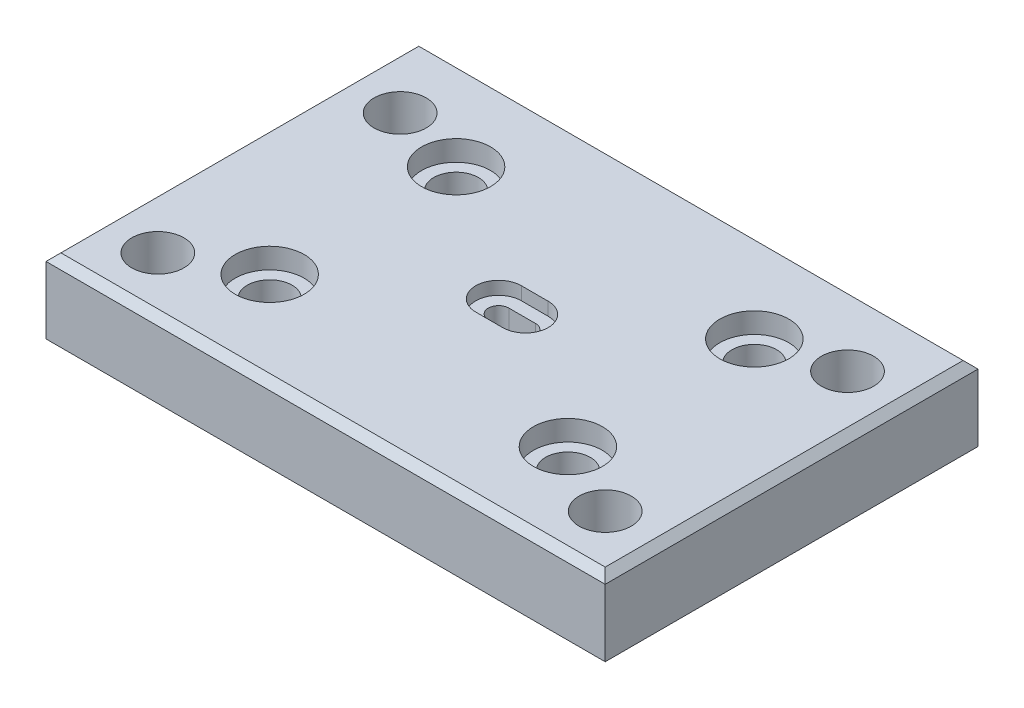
SolidWorks part; units mm, degrees
ref_plane "Front" through (0, 0, 0) normal (0, 0, 1) x (1, 0, 0)
ref_plane "Top" through (0, 0, 0) normal (0, 1, 0) x (1, 0, 0)
ref_plane "Right" through (0, 0, 0) normal (1, 0, 0) x (0, 0, -1)
sketch "Sketch1" plane through (0, 0, 0) normal (0, 1, 0) x (1, 0, 0)
  line L0 (75, -50) -> (-75, 50) construction
  line L1 (-75, 50) -> (75, 50)
  line L2 (-75, 50) -> (-75, -50)
  line L3 (-75, -50) -> (75, -50)
  line L4 (75, 50) -> (75, -50)
  dimension "D1" = 150
  dimension "D2" = 100
extrude "Extrude1" add sketch "Sketch1" along normal blind 20
chamfer "Chamfer1" distance 2 angle 45 4 edges at (-75, 20, 0) (0, 20, -50) (75, 20, 0) (0, 20, 50)
hole_wizard "CBORE for M10 SBHCS1" positions "Sketch4" profile "Sketch3" counterbore size "M10" standard "Ansi Metric"
sketch "Sketch4" plane through (0, 20, 0) normal (0, 1, 0) x (-1, 0, 0)
  line L0 (-75, 50) -> (75, 50) construction
  line L2 (75, 50) -> (75, -50) construction
  point P0 (40, 25)
  dimension "D1" = 25
  dimension "D2" = 35
sketch "Sketch3" plane through (-40, 20, 25) normal (1, 0, 0) x (0, 0, 1)
  line L0 (0, 0) -> (0, 20)
  line L1 (0, 20) -> (6, 20)
  line L3 (6, 20) -> (6, 5.5)
  line L4 (6, 5.5) -> (9.25, 5.5)
  line L5 (9.25, 5.5) -> (9.25, 0)
  line L7 (9.25, 0) -> (0, 0)
  line L11 (0, -6.35) -> (0, 107.95) construction
  dimension "Thru Hole Dia." = 12
  dimension "Thru Hole Depth" = 20
  dimension "C'Bore Dia." = 18.5
  dimension "C'Bore Depth" = 5.5
pattern_linear "LPattern2" count 2 spacing 80 along (1, 0, 0) count 2 spacing 50 along (0, 0, -1) of "CBORE for M10 SBHCS1"
hole_wizard "M16x2.0 Tapped Hole1" positions "Sketch8" profile "Sketch7" tap size "M16x2.0" standard "Ansi Metric"
sketch "Sketch8" plane through (0, 20, 0) normal (0, 1, 0) x (-1, 0, 0)
  line L0 (75, 50) -> (75, -50) construction
  line L1 (-75, 50) -> (75, 50) construction
  point P0 (60, 35)
  dimension "D1" = 15
  dimension "D2" = 15
sketch "Sketch7" plane through (-60, 20, 35) normal (1, 0, 0) x (0, 0, 1)
  line L0 (0, 0) -> (0, 20)
  line L1 (0, 20) -> (7, 20)
  line L2 (7, 20) -> (7, 0)
  line L5 (7, 0) -> (0, 0)
  line L11 (0, -6.35) -> (0, 107.95) construction
  dimension "Thru Tap Drill Dia." = 14
  dimension "Thru Tap Drill Depth" = 20
pattern_linear "LPattern3" count 2 spacing 65 along (0, 0, -1) count 2 spacing 120 along (1, 0, 0) of "M16x2.0 Tapped Hole1"
hole_wizard "CBORE SLOT for M5 Hex Head Bolt2" positions "Sketch13" profile "Sketch11" size "M5" standard "ISO"
sketch "Sketch13" plane through (0, 20, 0) normal (0, 1, 0) x (1, 0, 0)
  line L0 (-6.35, 0) -> (6.35, 0) construction
  point P0 (0, 0)
  dimension "D1" = 12.7
sketch "Sketch11" plane through (0, 20, 0) normal (1, 0, 0) x (0, 0, 1)
  line L0 (0, 0) -> (0, 26.6524)
  line L1 (0, 26.6524) -> (2.75, 25)
  line L2 (2.75, 25) -> (2.75, 3.5)
  line L3 (2.75, 3.5) -> (6.119, 3.5)
  line L4 (6.119, 3.5) -> (6.119, 0)
  line L5 (6.119, 0) -> (0, 0)
  line L10 (0, 26.6524) -> (-2.75, 25) construction
  line L11 (0, -6.35) -> (0, 107.95) construction
  dimension "Hole Dia." = 5.5
  dimension "Hole Depth" = 25
  dimension "C'Bore Dia." = 12.238
  dimension "C'Bore Depth" = 3.5
  dimension "Drill Angle" = 118
